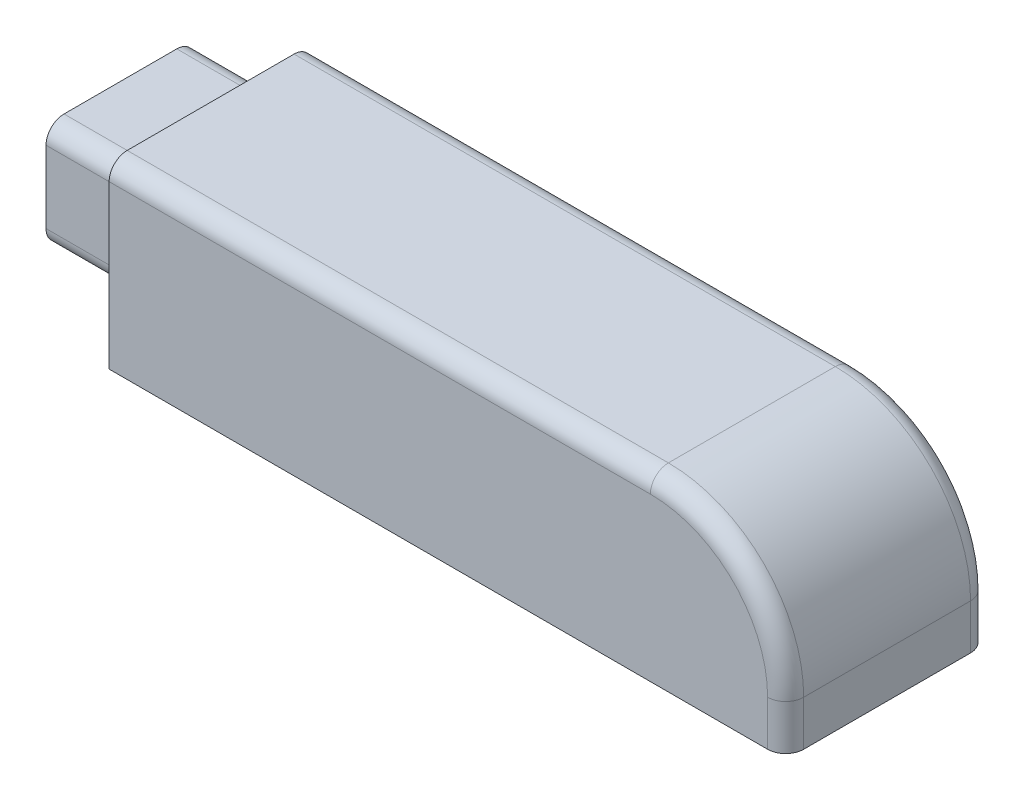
SolidWorks part; units mm, degrees
ref_plane "Ebene vorne" through (0, 0, 0) normal (0, 0, 1) x (1, 0, 0)
ref_plane "Ebene oben" through (0, 0, 0) normal (0, 1, 0) x (1, 0, 0)
ref_plane "Ebene rechts" through (0, 0, 0) normal (1, 0, 0) x (0, 0, -1)
sketch "Skizze1" plane through (0, 0, 0) normal (0, 1, 0) x (1, 0, 0)
  line L1 (110, -22.5) -> (-40, -22.5)
  line L2 (110, -22.5) -> (110, 22.5)
  line L3 (110, 22.5) -> (-40, 22.5)
  line L4 (-40, -22.5) -> (-40, 22.5)
  point P0 (0, 0)
  point P6 (-40, 0)
  dimension "D1" = 45
  dimension "D2" = 150
  dimension "D3" = 40
extrude "Aufsatz-Linear austragen1" add sketch "Skizze1" along normal blind 40
sketch "Skizze8" plane through (-40, 0, 0) normal (1, 0, 0) x (0, 0, -1)
  line L0 (-22.5, 40) -> (22.5, 40) construction
  line L1 (-16.5, 10) -> (16.5, 10)
  line L2 (-16.5, 10) -> (-16.5, 34)
  line L3 (-16.5, 34) -> (16.5, 34)
  line L4 (16.5, 10) -> (16.5, 34)
  line L5 (-16.5, 10) -> (16.5, 34) construction
  line L6 (-16.5, 34) -> (16.5, 10) construction
  line L7 (-22.5, 0) -> (22.5, 0) construction
  point P0 (0, 22)
  point P9 (0, 0)
  dimension "D1" = 6
  dimension "D2" = 10
  dimension "D3" = 33
extrude "Aufsatz-Linear austragen6" add sketch "Skizze8" against normal blind 20
sketch "Skizze10" plane through (0, 0, 0) normal (0, -1, 0) x (1, 0, 0)
  line L0 (-40, 16.5) -> (-40, -16.5) construction
  line L1 (-40, 8.5) -> (90, 8.5)
  line L2 (-40, 8.5) -> (-40, -8.5)
  line L3 (-40, -8.5) -> (90, -8.5)
  line L4 (90, 8.5) -> (90, -8.5)
  line L5 (-40, 8.5) -> (90, -8.5) construction
  line L6 (-40, -8.5) -> (90, 8.5) construction
  point P0 (25, 0)
  dimension "D1" = 17
  dimension "D2" = 130
extrude "Schnitt-Linear austragen4" cut sketch "Skizze10" against normal blind 6
fillet "Verrundung1" radius 30 1 edges at (110, 40, 0)
fillet "Verrundung2" radius 4 6 edges at (110, 5, -22.5) (101.2132, 31.2132, -22.5) (110, 5, 22.5) (101.2132, 31.2132, 22.5) (20, 40, -22.5) (20, 40, 22.5)
fillet "Verrundung3" radius 4 4 edges at (-50, 10, -16.5) (-50, 10, 16.5) (-50, 34, -16.5) (-50, 34, 16.5)
